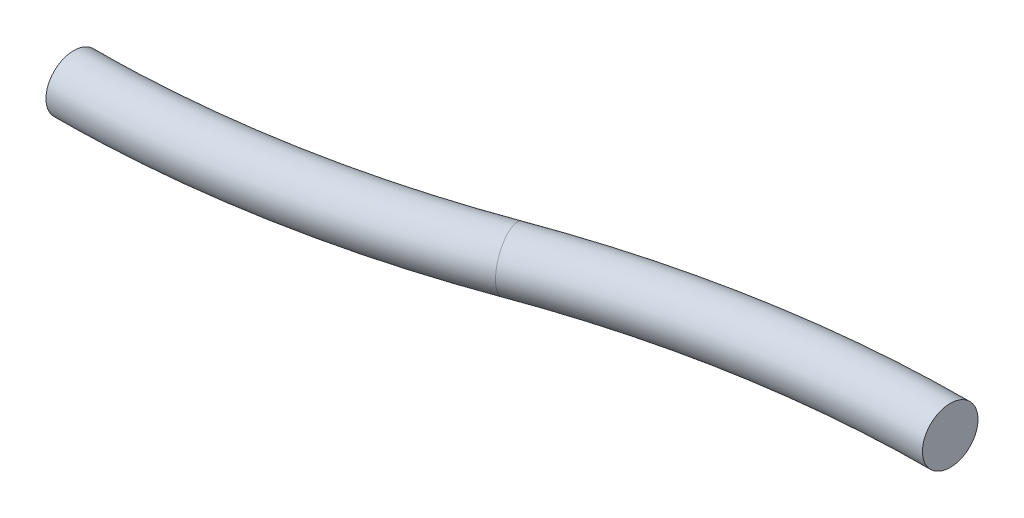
SolidWorks part; units mm, degrees
ref_plane "Front Plane" through (0, 0, 0) normal (0, 0, 1) x (1, 0, 0)
ref_plane "Top Plane" through (0, 0, 0) normal (0, 1, 0) x (1, 0, 0)
ref_plane "Right Plane" through (0, 0, 0) normal (1, 0, 0) x (0, 0, -1)
sketch "Sketch1" plane through (0, 0, 0) normal (0, 1, 0) x (1, 0, 0)
  line L0 (0, 0) -> (-66.259, 0) construction
  line L1 (0, 0) -> (127.508, 0) construction
  line L2 (127.508, 0) -> (127.508, 22.7457) construction
  line L3 (127.508, 22.7457) -> (140.5364, 22.7457) construction
  arc A0 (0, 0) -> (63.754, 11.3729) centre (0, 184.3827) ccw
  arc A1 (63.754, 11.3729) -> (127.508, 22.7457) centre (127.508, -161.637) cw
  dimension "D1" = 127.508
  dimension "D2" = 22.7457
sketch "Sketch2" plane through (0, 0, 0) normal (1, 0, 0) x (0, 0, -1)
  circle A0 centre (0, 0) radius 4.7625
  dimension "D1" = 9.525
sweep "Sweep1" add profiles "Sketch2" path "Sketch1"
